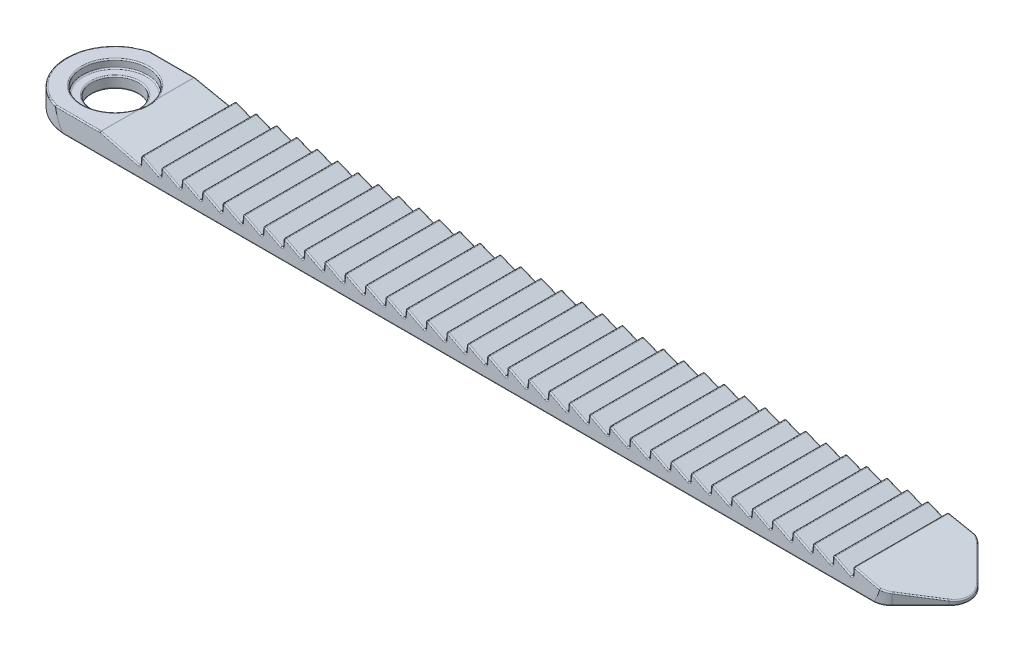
SolidWorks part; units mm, degrees
ref_plane "Face" through (0, 0, 0) normal (0, 0, 1) x (1, 0, 0)
ref_plane "Dessus" through (0, 0, 0) normal (0, 1, 0) x (1, 0, 0)
ref_plane "Droite" through (0, 0, 0) normal (1, 0, 0) x (0, 0, -1)
sketch "Esquisse1" plane through (0, 0, 0) normal (0, 1, 0) x (1, 0, 0)
  line L0 (-22.5776, 0) -> (227.4274, 0) construction
  line L1 (0, 12) -> (197.9289, 12)
  line L2 (201.4645, 10.5355) -> (208.4645, 3.5355)
  line L3 (0, -12) -> (197.9289, -12)
  line L4 (208.4645, -3.5355) -> (201.4645, -10.5355)
  arc A0 (0, 12) -> (0, -12) centre (0, 0) ccw
  arc A1 (208.4645, 3.5355) -> (208.4645, -3.5355) centre (204.9289, 0) cw
  arc A2 (197.9289, 12) -> (201.4645, 10.5355) centre (197.9289, 7) cw
  arc A3 (197.9289, -12) -> (201.4645, -10.5355) centre (197.9289, -7) ccw
  point P11 (212, 0)
  point P14 (200, 12)
  point P17 (200, -12)
  dimension "D3" = 5
  dimension "D1" = 24
  dimension "D2" = 200
extrude "Extrusion1" add sketch "Esquisse1" along normal blind 4.8
sketch "Esquisse2" plane through (0, 0, 0) normal (0, 0, 1) x (1, 0, 0)
  line L0 (8, 4.8) -> (18, 2.5)
  line L1 (0, 4.8) -> (197.9289, 4.8) construction
  line L2 (18, 2.5) -> (18, 4.8)
  line L3 (0, 0) -> (197.9289, 0) construction
  line L4 (8, 4.8) -> (18, 4.8)
  dimension "D1" = 8
  dimension "D2" = 10
  dimension "D3" = 2.5
extrude "Extrusion2" cut sketch "Esquisse2" against normal through all and the other way through all
sketch "Esquisse3" plane through (0, 0, 0) normal (0, 0, 1) x (1, 0, 0)
  line L0 (18, 4.8) -> (197.9289, 4.8) construction
  line L1 (18, 4.8) -> (23, 4.8)
  line L2 (18, 4.8) -> (23, 2.5)
  line L3 (23, 2.5) -> (23, 4.8)
  line L4 (18, 2.5) -> (18, 4.8) construction
  dimension "D1" = 5
extrude "Extrusion3" cut sketch "Esquisse3" against normal through all and the other way through all
pattern_linear "Répétition linéaire1" count 35 spacing 5 along (1, 0, 0) of "Extrusion3"
sketch "Esquisse6" plane through (0, 0, 0) normal (0, 0, 1) x (1, 0, 0)
  line L0 (193, 4.8) -> (209.9289, 1)
  line L1 (209.9289, 0) -> (209.9289, 4.8) construction
  line L2 (201.4645, 0) -> (208.4645, 0) construction
  line L3 (193, 4.8) -> (209.9289, 4.8)
  line L4 (209.9289, 4.8) -> (209.9289, 1)
  dimension "D1" = 1
extrude "Extrusion4" cut sketch "Esquisse6" against normal through all and the other way through all
sketch "Esquisse7" plane through (0, 0, 0) normal (1, 0, 0) x (0, 0, -1)
  line L0 (12, 0) -> (11.5801, 4.8)
  line L1 (-12, 0) -> (-11.5801, 4.8)
  line L2 (12, 4.8) -> (-12, 4.8) construction
  line L3 (12, 4.8) -> (11.5801, 4.8)
  line L4 (12, 4.8) -> (12, 0) construction
  line L5 (12, 4.8) -> (12, 0)
  line L6 (-12, 4.8) -> (-12, 0) construction
  line L7 (-12, 4.8) -> (-12, 0)
  line L8 (-11.5801, 4.8) -> (-12, 4.8)
  dimension "D1" = 5
  dimension "D2" = 5
extrude "Extrusion5" cut sketch "Esquisse7" against normal through all and the other way through all
hole_wizard "Perçage1" positions "Esquisse9" profile "Esquisse8" legacy
sketch "Esquisse9" plane through (0, 4.8, 0) normal (0, 1, 0) x (-1, 0, 0)
  point P0 (0, 0)
sketch "Esquisse8" plane through (0, 4.8, 0) normal (1, 0, 0) x (0, 0, 1)
  line L0 (0, 0) -> (0, 8.2549)
  line L1 (0, 8.2549) -> (5.75, 4.8)
  line L2 (5.75, 4.8) -> (5.75, 2)
  line L3 (5.75, 2) -> (8, 2)
  line L4 (8, 0) -> (0, 0)
  line L5 (0, -11.3109) -> (0, 121.1557) construction
  line L6 (0, 8.2549) -> (-5.75, 4.8) construction
  line L7 (8, 2) -> (8, 0)
  dimension "Diamètre" = 11.5
  dimension "Profondeur" = 4.8
  dimension "Diamètre chambrage" = 16
  dimension "Profondeur chambrage" = 2
  dimension "Angle" = 118
fillet "Congé1" radius 0.3 9 edges at (204.9645, 0, -7.0355) (199.8423, 0, -11.6194) (98.9645, 0, -12) (-12, 0, 0) (98.9645, 0, 12) (199.8423, 0, 11.6194) (204.9645, 0, 7.0355) (209.9289, 0, 0) (0, 0, 5.75)
fillet "Congé2" radius 0.3 69 edges at (33, 3.65, 11.6807) (30.5, 3.65, -11.6807) (25.5, 3.65, -11.6807) (25.5, 3.65, 11.6807) (23, 4.8, 0) (20.5, 3.65, -11.6807) (18, 2.5, 0) (8, 4.8, -5.79) (118, 3.65, -11.6807) (108, 3.65, -11.6807) (108, 3.65, 11.6807) (68, 3.65, 11.6807) (63, 3.65, -11.6807) (53, 3.65, -11.6807) (53, 3.65, 11.6807) (43, 3.65, -11.6807) (43, 3.65, 11.6807) (38, 3.65, 11.6807) (128, 2.5, 0) (118, 2.5, 0) (115.5, 3.65, 11.6807) (113, 4.8, 0) (110.5, 3.65, -11.6807) (113, 2.5, 0) (98, 4.8, 0) (93, 4.8, 0) (90.5, 3.65, -11.6807) (88, 2.5, 0) (80.5, 3.65, 11.6807) (78, 4.8, 0) (75.5, 3.65, -11.6807) (73, 2.5, 0) (70.5, 3.65, 11.6807) (68, 2.5, 0) (63, 4.8, 0) (63, 2.5, 0) (53, 2.5, 0) (45.5, 3.65, -11.6807) (48, 2.5, 0) (45.5, 3.65, 11.6807) (40.5, 3.65, -11.6807) (40.5, 3.65, 11.6807) (33, 4.8, 0) (188, 3.65, 11.6807) (183, 3.65, -11.6807) (178, 3.65, 11.6807) (173, 3.65, 11.6807) (168, 3.65, -11.6807) (168, 3.65, 11.6807) (143, 3.65, -11.6807) (133, 3.65, -11.6807) (133, 3.65, 11.6807) (196.3038, 4.0584, -11.6449) (204.9645, 2.1144, 7.0355) (200.6013, 3.0938, 11.2259) (180.5, 3.65, -11.6807) (178, 2.5, 0) (173, 2.5, 0) (165.5, 3.65, 11.6807) (150.5, 3.65, 11.6807) (145.5, 3.65, -11.6807) (148, 2.5, 0) (143, 4.8, 0) (140.5, 3.65, -11.6807) (143, 2.5, 0) (140.5, 3.65, 11.6807) (138, 2.5, 0) (135.5, 3.65, 11.6807) (130.5, 3.65, 11.6807)
fillet "Congé3" radius 0.3 8 edges at (7.9998, 4.7981, -11.3383) (7.9998, 4.7981, 11.3383) (-12, 4.8, 0) (1.8142, 4.8, -11.5801) (-8, 4.8, 0) (1.8142, 4.8, 11.5801) (0, 2.8, 8) (0, 2.8, 5.75)
